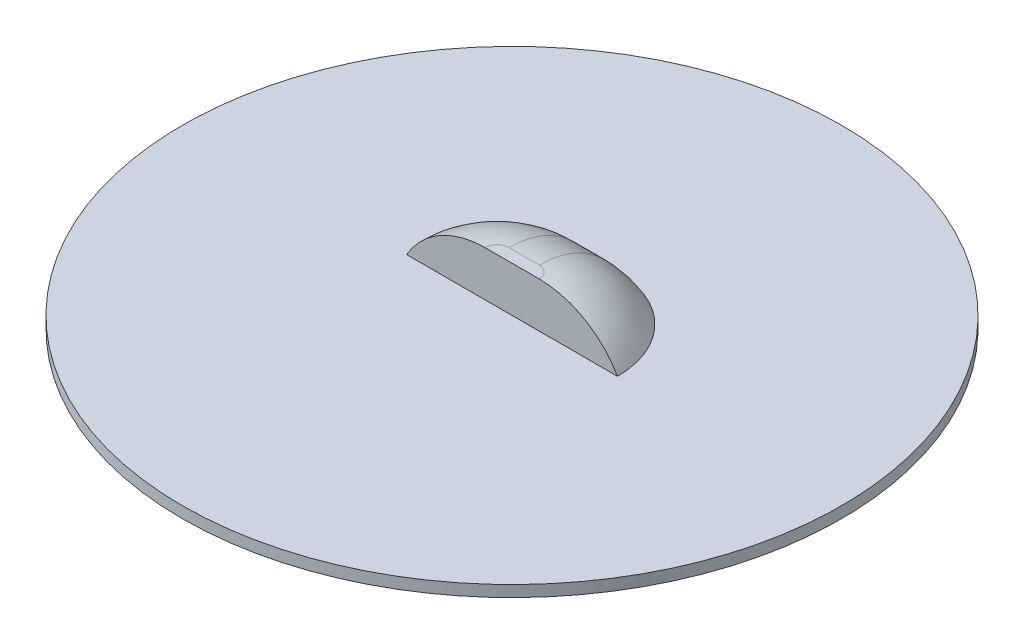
SolidWorks part; units mm, degrees
ref_plane "Front Plane" through (0, 0, 0) normal (0, 0, 1) x (1, 0, 0)
ref_plane "Top Plane" through (0, 0, 0) normal (0, 1, 0) x (1, 0, 0)
ref_plane "Right Plane" through (0, 0, 0) normal (1, 0, 0) x (0, 0, -1)
sketch "Sketch1" plane through (0, 0, 0) normal (0, 1, 0) x (1, 0, 0)
  line L1 (-25.4, 25.4) -> (25.4, 25.4) construction
  line L2 (-25.4, 25.4) -> (-25.4, -25.4) construction
  line L3 (-25.4, -25.4) -> (25.4, -25.4) construction
  line L4 (25.4, 25.4) -> (25.4, -25.4) construction
  line L5 (-25.4, 25.4) -> (25.4, -25.4) construction
  line L6 (-25.4, -25.4) -> (25.4, 25.4) construction
  circle A0 centre (0, 0) radius 44.45
  point P0 (0, 0)
  dimension "D3" = 88.9
  dimension "D1" = 50.8
  dimension "D2" = 50.8
extrude "Extrude1" add sketch "Sketch1" along normal blind 1.524
sketch "Sketch3" plane through (0, 1.524, 0) normal (0, 1, 0) x (-1, 0, 0)
  line L0 (14.224, -0.0087) -> (-14.2228, -0.0087)
  line L8 (2.0419, -12.1908) -> (-2.0407, -12.1908)
  line L11 (25.4, -12.1908) -> (-25.4, -12.1908) construction
  line L15 (25.4, -0.0087) -> (-25.4, -0.0087) construction
  arc A0 (-14.2228, -0.0087) -> (-2.0407, -12.1908) centre (-2.0407, -0.0087) ccw
  arc A1 (2.0419, -12.1908) -> (14.224, -0.0087) centre (2.0419, -0.0087) ccw
extrude "Extrude2" add sketch "Sketch3" along normal blind 6.096
fillet "Fillet1" radius 12.192 3 edges at (10.6548, 7.62, -8.6228) (-0.0006, 7.62, -12.1908) (-10.656, 7.62, -8.6228)
